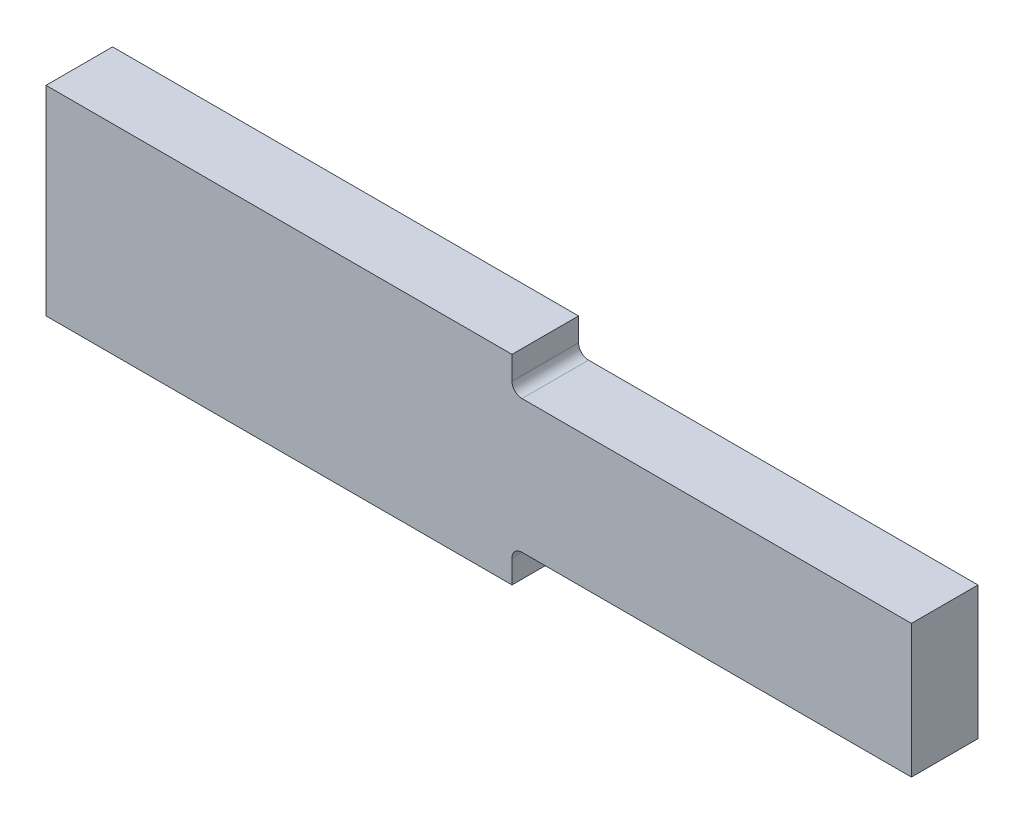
SolidWorks part; units mm, degrees
ref_plane "Ebene vorne" through (0, 0, 0) normal (0, 0, 1) x (1, 0, 0)
ref_plane "Ebene oben" through (0, 0, 0) normal (0, 1, 0) x (1, 0, 0)
ref_plane "Ebene rechts" through (0, 0, 0) normal (1, 0, 0) x (0, 0, -1)
sketch "Skizze1" plane through (0, 0, 0) normal (0, 0, 1) x (1, 0, 0)
  line L0 (0, -30) -> (0, 30)
  line L1 (0, 30) -> (140, 30)
  line L2 (140, 30) -> (140, 20)
  line L3 (140, 20) -> (260, 20)
  line L4 (260, 20) -> (260, -20)
  line L5 (260, -20) -> (140, -20)
  line L6 (140, -20) -> (140, -30)
  line L7 (140, -30) -> (0, -30)
  line L8 (-10.5417, 0) -> (297.9299, 0) construction
  dimension "D1" = 60
  dimension "D2" = 140
  dimension "D3" = 40
  dimension "D4" = 260
extrude "Aufsatz-Linear austragen1" add sketch "Skizze1" along normal blind 20
fillet "Verrundung1" radius 3 2 edges at (140, -20, 10) (140, 20, 10)
